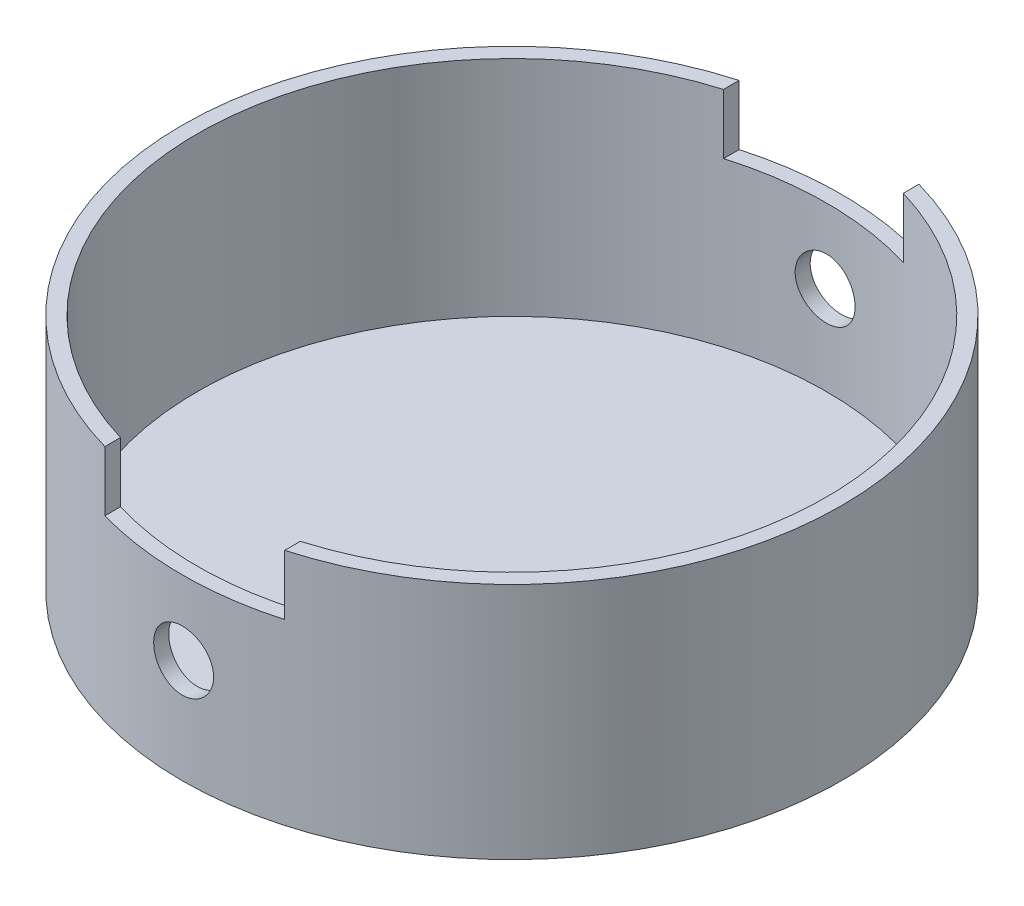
SolidWorks part; units mm, degrees
other "DetailItem1" parameters "RD1"=139.7, "RD2"=38.1, "RD3"=22.0726, "RD4"=3.175, "RD5"=50.4952, "RD6"=12.7
ref_plane "Front Plane" through (0, 0, 0) normal (0, 0, 1) x (1, 0, 0)
ref_plane "Top Plane" through (0, 0, 0) normal (0, 1, 0) x (1, 0, 0)
ref_plane "Right Plane" through (0, 0, 0) normal (1, 0, 0) x (0, 0, -1)
sketch "Sketch1" plane through (0, 0, 0) normal (0, 1, 0) x (1, 0, 0)
  circle A0 centre (0, 0) radius 69.85
  arc A1 (0, -69.85) -> (0, 69.85) centre (0, 0) ccw construction
extrude "Extrude1" add sketch "Sketch1" along normal blind 50.4952
shell "Shell1" thickness 3.175
sketch "Sketch2" plane through (0, 0, 0) normal (0, 0, 1) x (1, 0, 0)
  line L0 (66.675, 50.4952) -> (-66.675, 50.4952) construction
  line L1 (-19.05, 50.4952) -> (19.05, 50.4952)
  line L2 (-19.05, 50.4952) -> (-19.05, 37.7952)
  line L3 (-19.05, 37.7952) -> (19.05, 37.7952)
  line L4 (19.05, 50.4952) -> (19.05, 37.7952)
  line L5 (0, 37.7952) -> (0, 0) construction
  dimension "D1" = 38.1
  dimension "D2" = 12.7
extrude "Extrude2" cut sketch "Sketch2" against normal through all and the other way through all
sketch "Sketch3" plane through (0, 0, 0) normal (0, 0, 1) x (1, 0, 0)
  line L0 (-69.85, 0) -> (69.85, 0) construction
  line L1 (0, 22.0726) -> (0, 0) construction
  circle A0 centre (0, 22.0726) radius 6.35
  dimension "D1" = 12.7
  dimension "D2" = 22.0726
extrude "Extrude3" cut sketch "Sketch3" against normal through all and the other way through all
sketch "Sketch5" plane through (0, 50.4952, 0) normal (0, 1, 0) x (1, 0, 0)
  line L0 (0, 0) -> (69.85, 0)
  arc A0 (19.05, -67.2021) -> (19.05, 67.2021) centre (0, 0) ccw construction
